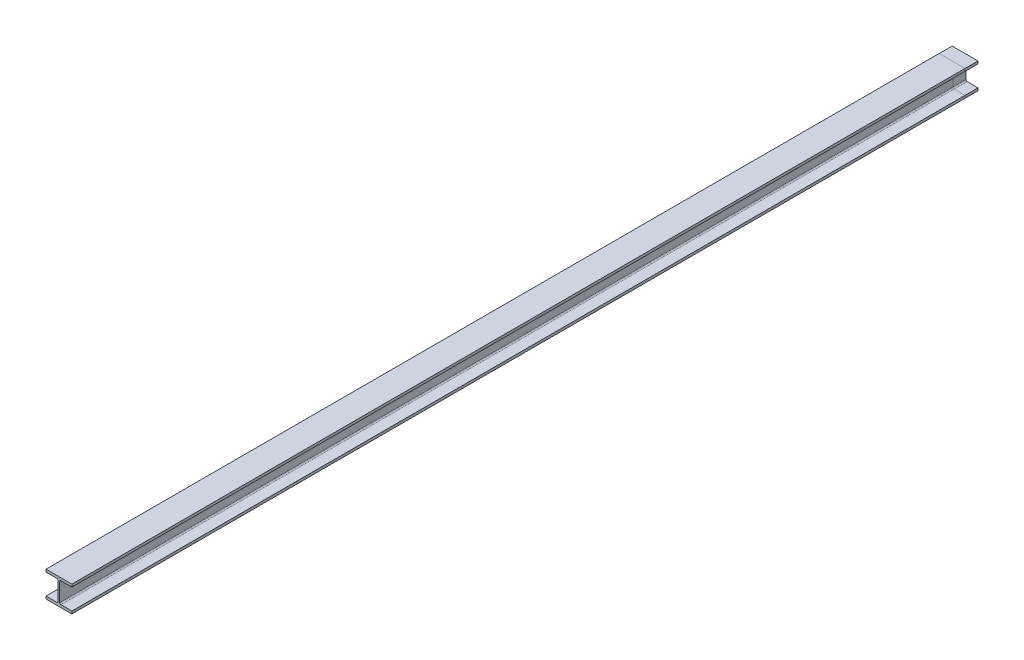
SolidWorks part; units mm, degrees
ref_plane "Front Plane" through (0, 0, 0) normal (0, 0, 1) x (1, 0, 0)
ref_plane "Top Plane" through (0, 0, 0) normal (0, 1, 0) x (1, 0, 0)
ref_plane "Right Plane" through (0, 0, 0) normal (1, 0, 0) x (0, 0, -1)
sketch "Sketch1" plane through (0, 0, 0) normal (0, 0, 1) x (1, 0, 0)
  line L0 (-60.105, 0) -> (66.4042, 0) construction
  line L1 (0, 54.9869) -> (0, -69.1601) construction
  line L2 (-50, 50) -> (50, 50)
  line L3 (50, 50) -> (50, 40)
  line L4 (50, 40) -> (8, 40)
  line L5 (3, 35) -> (3, -35)
  line L6 (50, -40) -> (8, -40)
  line L7 (50, -50) -> (50, -40)
  line L8 (-50, -50) -> (50, -50)
  line L9 (-50, -40) -> (-8, -40)
  line L10 (-50, -50) -> (-50, -40)
  line L11 (-3, 35) -> (-3, -35)
  line L12 (-50, 40) -> (-8, 40)
  line L13 (-50, 50) -> (-50, 40)
  arc A0 (8, -40) -> (3, -35) centre (8, -35) cw
  arc A1 (-3, -35) -> (-8, -40) centre (-8, -35) cw
  arc A2 (8, 40) -> (3, 35) centre (8, 35) ccw
  arc A3 (-3, 35) -> (-8, 40) centre (-8, 35) ccw
  point P11 (3, 0)
  point P17 (0, -50)
  point P20 (0, 50)
  point P22 (3, -40)
  point P25 (-3, -40)
  point P28 (3, 40)
  point P31 (-3, 40)
  dimension "D5" = 5
  dimension "D1" = 100
  dimension "D2" = 100
  dimension "D3" = 6
  dimension "D4" = 10
extrude "Boss-Extrude1" add sketch "Sketch1" along normal mid plane 3500
ref_plane "Plane2" through (0, 0, -1700) normal (0, 0, -1) x (-1, 0, 0)
